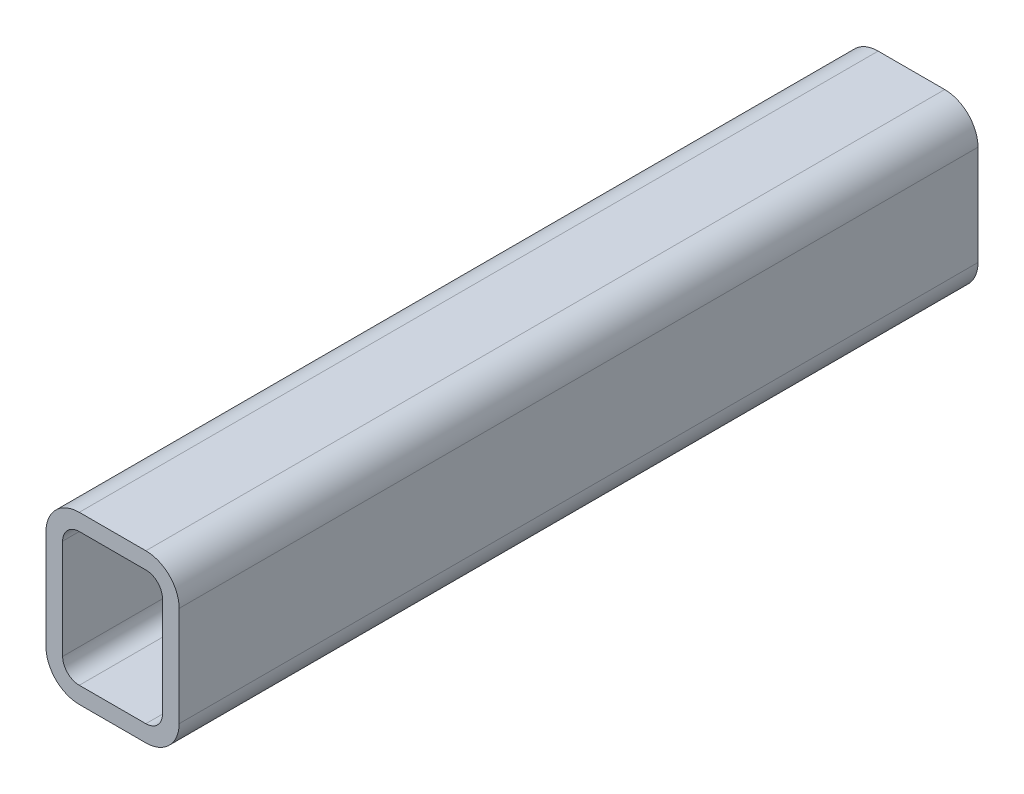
SolidWorks part; units mm, degrees
ref_plane "Front Plane" through (0, 0, 0) normal (0, 0, 1) x (1, 0, 0)
ref_plane "Top Plane" through (0, 0, 0) normal (0, 1, 0) x (1, 0, 0)
ref_plane "Right Plane" through (0, 0, 0) normal (1, 0, 0) x (0, 0, -1)
sketch "Sketch1" plane through (0, 0, 0) normal (0, 0, 1) x (1, 0, 0)
  line B0 (12.7, 63.5) -> (38.1, 63.5)
  arc B1 (50.8, 50.8) -> (38.1, 63.5) centre (38.1, 50.8) ccw
  line B2 (50.8, 50.8) -> (50.8, 12.7)
  arc B3 (38.1, 0) -> (50.8, 12.7) centre (38.1, 12.7) ccw
  line B4 (38.1, 0) -> (12.7, 0)
  arc B5 (0, 12.7) -> (12.7, 0) centre (12.7, 12.7) ccw
  line B6 (0, 12.7) -> (0, 50.8)
  arc B7 (12.7, 63.5) -> (0, 50.8) centre (12.7, 50.8) ccw
  line B8 (12.7, 57.15) -> (38.1, 57.15)
  arc B9 (44.45, 50.8) -> (38.1, 57.15) centre (38.1, 50.8) ccw
  line B10 (44.45, 50.8) -> (44.45, 12.7)
  arc B11 (38.1, 6.35) -> (44.45, 12.7) centre (38.1, 12.7) ccw
  line B12 (38.1, 6.35) -> (12.7, 6.35)
  arc B13 (6.35, 12.7) -> (12.7, 6.35) centre (12.7, 12.7) ccw
  line B14 (6.35, 12.7) -> (6.35, 50.8)
  arc B15 (12.7, 57.15) -> (6.35, 50.8) centre (12.7, 50.8) ccw
sketch_block_instance "HSS2.5x2x0.250-1"
sketch_block "HSS2.5x2x0.250"
extrude "Boss-Extrude1" add sketch "Sketch1" along normal blind 304.8
